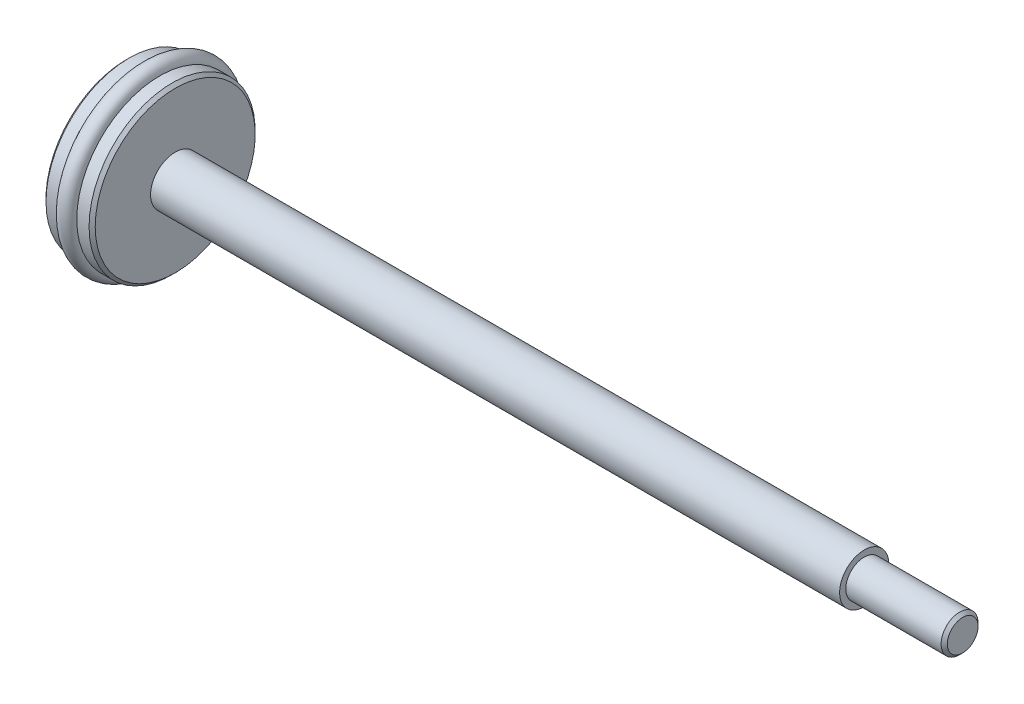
SolidWorks part; units mm, degrees
ref_plane "Face" through (0, 0, 0) normal (0, 0, 1) x (1, 0, 0)
ref_plane "Dessus" through (0, 0, 0) normal (0, 1, 0) x (1, 0, 0)
ref_plane "Droite" through (0, 0, 0) normal (1, 0, 0) x (0, 0, -1)
sketch "Esquisse1" plane through (0, 0, 0) normal (0, 0, 1) x (1, 0, 0)
  line L0 (-30.406, 0) -> (51.9305, 0) construction
  line L1 (0, 0) -> (240, 0)
  line L2 (240, 6) -> (240, 8)
  line L3 (240, 8) -> (16, 8)
  line L4 (16, 8) -> (16, 26)
  line L5 (15, 27) -> (11, 27)
  line L6 (11, 27) -> (10.25, 23.9)
  line L7 (10.25, 23.9) -> (5.75, 23.9)
  line L8 (5.75, 23.9) -> (5, 27)
  line L9 (5, 27) -> (1, 27)
  line L10 (0, 26) -> (0, 0)
  line L11 (240, 6) -> (271, 6)
  line L12 (272, 5) -> (272, 0)
  line L13 (272, 0) -> (240, 0)
  line L14 (271, 6) -> (272, 5)
  line L15 (16, 26) -> (15, 27)
  line L16 (1, 27) -> (0, 26)
  circle A0 centre (7.994, 26.7256) radius 2.773
  point P8 (16, 27)
  point P13 (0, 27)
  point P14 (272, 6)
  dimension "D1" = 54
  dimension "D2" = 54
  dimension "D3" = 16
  dimension "D4" = 5
  dimension "D5" = 5
  dimension "D6" = 4.5
  dimension "D7" = 3.1
  dimension "D8" = 0.75
  dimension "D9" = 16
  dimension "D10" = 240
  dimension "D11" = 6
  dimension "D12" = 32
  dimension "D15" = 1
  dimension "D16" = 1
  dimension "D17" = 1
revolve "Révolution1" add sketch "Esquisse1" angle 360 about L0
